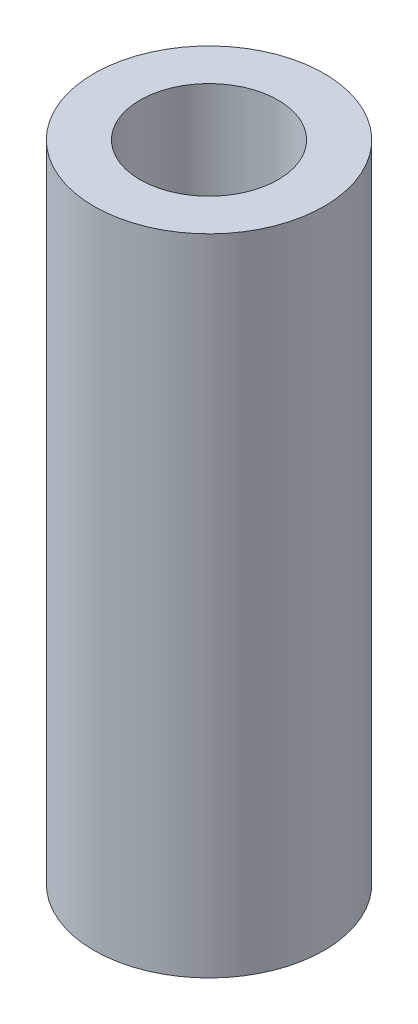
SolidWorks part; units mm, degrees
ref_plane "Face" through (0, 0, 0) normal (0, 0, 1) x (1, 0, 0)
ref_plane "Dessus" through (0, 0, 0) normal (0, 1, 0) x (1, 0, 0)
ref_plane "Droite" through (0, 0, 0) normal (1, 0, 0) x (0, 0, -1)
sketch "Esquisse1" plane through (0, 0, 0) normal (0, 1, 0) x (1, 0, 0)
  circle A0 centre (0, 0) radius 1.25
  circle A1 centre (0, 0) radius 0.75
  dimension "D1" = 1.5
  dimension "D2" = 2.5
extrude "Base-Extrusion" add sketch "Esquisse1" along normal blind 7
